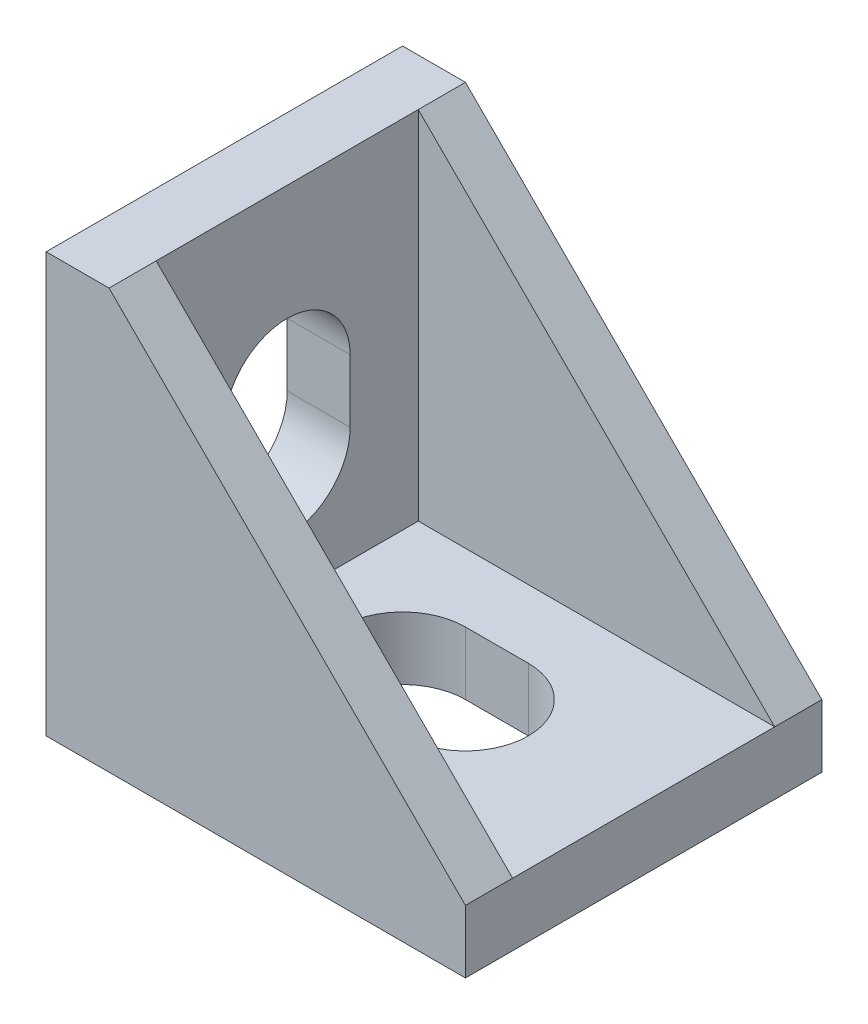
SolidWorks part; units mm, degrees
ref_plane "前视基准面" through (0, 0, 0) normal (0, 0, 1) x (1, 0, 0)
ref_plane "上视基准面" through (0, 0, 0) normal (0, 1, 0) x (1, 0, 0)
ref_plane "右视基准面" through (0, 0, 0) normal (1, 0, 0) x (0, 0, -1)
sketch "草图1" plane through (0, 0, 0) normal (0, 0, 1) x (1, 0, 0)
  line L1 (-10, 10) -> (10, 10)
  line L2 (-10, 10) -> (-10, -10)
  line L3 (-10, -10) -> (10, -10)
  line L4 (10, 10) -> (10, -10)
  dimension "D1" = 20
  dimension "D2" = 20
  dimension "D3" = 10
extrude "凸台-拉伸1" add sketch "草图1" along normal mid plane 17
sketch "草图2" plane through (0, 0, -8.5) normal (0, 0, -1) x (-1, 0, 0)
  line L0 (7, 10) -> (-10, 10)
  line L1 (-10, 10) -> (10, 10) construction
  line L2 (-10, 10) -> (-10, -7)
  line L3 (-10, -10) -> (-10, 10) construction
  line L4 (-10, -7) -> (7, 10)
  dimension "D1" = 17
  dimension "D2" = 17
extrude "切除-拉伸1" cut sketch "草图2" against normal through all
sketch "草图3" plane through (0, 10, 0) normal (0, 1, 0) x (1, 0, 0)
  line L0 (-7, -8.5) -> (-7, 8.5) construction
  line L1 (-7, 6.25) -> (10, 6.25)
  line L2 (-7, 6.25) -> (-7, -6.25)
  line L4 (10, 6.25) -> (10, -6.25)
  line L5 (10, -8.5) -> (10, 8.5) construction
  line L6 (10, 8.5) -> (-7, 8.5) construction
  line L8 (-7, -6.25) -> (10, -6.25)
  dimension "D1" = 12.5
  dimension "D2" = 2.25
extrude "切除-拉伸2" cut sketch "草图3" against normal blind 17
sketch "草图4" plane through (-10, 0, 0) normal (-1, 0, 0) x (0, 0, 1)
  line L0 (0, 1.5) -> (0, -1.5) construction
  line L1 (3, 1.5) -> (3, -1.5)
  line L2 (-3, 1.5) -> (-3, -1.5)
  arc A0 (3, 1.5) -> (-3, 1.5) centre (0, 1.5) ccw
  arc A1 (-3, -1.5) -> (3, -1.5) centre (0, -1.5) ccw
  point P3 (0, 0)
  dimension "D1" = 3
  dimension "D2" = 3
  dimension "D3" = 0
extrude "切除-拉伸3" cut sketch "草图4" against normal blind 17
sketch "草图5" plane through (-10, 0, 0) normal (-1, 0, 0) x (0, 0, 1)
  line L0 (0, 9) -> (0, 5.2585) construction
  line L1 (-1.8, 9) -> (1.8, 9)
  line L2 (-1.8, 9) -> (-1.8, 7.5)
  line L3 (-1.8, 7.5) -> (1.8, 7.5)
  line L4 (1.8, 9) -> (1.8, 7.5)
  line L6 (-8.5, 10) -> (-8.5, -10) construction
  line L7 (8.5, 10) -> (-8.5, 10) construction
  line L8 (-1.8, -7) -> (1.8, -7)
  line L9 (-1.8, -8.5) -> (1.8, -8.5)
  line L10 (-1.8, -7) -> (-1.8, -8.5)
  line L11 (1.8, -7) -> (1.8, -8.5)
  line L12 (8.5, -10) -> (-8.5, -10) construction
  dimension "D1" = 3.6
  dimension "D2" = 1.5
  dimension "D3" = 8.5
  dimension "D4" = 1
  dimension "D5" = 1.5
extrude "凸台-拉伸2" add sketch "草图5" along normal blind 1
ref_plane "基准面1" through (0, 0, 0) normal (0.7071, -0.7071, 0) x (-0.7071, -0.7071, 0)
mirror "镜向1" about plane through (0, 0, 0) normal (0.7071, -0.7071, 0) of "切除-拉伸3", "凸台-拉伸2"
